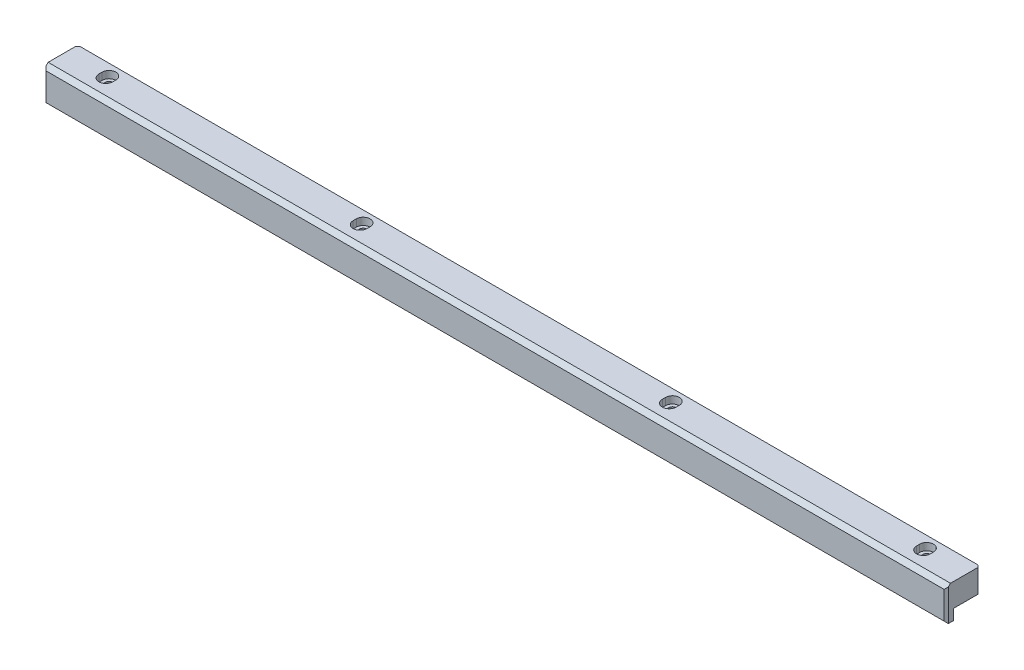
SolidWorks part; units mm, degrees
ref_plane "前视基准面" through (0, 0, 0) normal (0, 0, 1) x (1, 0, 0)
ref_plane "上视基准面" through (0, 0, 0) normal (0, 1, 0) x (1, 0, 0)
ref_plane "右视基准面" through (0, 0, 0) normal (1, 0, 0) x (0, 0, -1)
sketch "草图1" plane through (0, 0, 0) normal (0, 1, 0) x (1, 0, 0)
  line L1 (-213, 8) -> (213, 8)
  line L2 (-213, 8) -> (-213, -8)
  line L3 (-213, -8) -> (213, -8)
  line L4 (213, 8) -> (213, -8)
  line L5 (-213, 8) -> (213, -8) construction
  line L6 (-213, -8) -> (213, 8) construction
  point P0 (0, 0)
  dimension "D1" = 426
  dimension "D2" = 16
extrude "凸台-拉伸1" add sketch "草图1" along normal blind 16
sketch "草图19" plane through (0, 0, 0) normal (0, -1, 0) x (1, 0, 0)
  line L0 (213, 8) -> (213, -8) construction
  line L1 (-213, -8) -> (213, -8)
  line L2 (-213, -8) -> (-213, 4.5)
  line L3 (-213, 4.5) -> (213, 4.5)
  line L4 (213, -8) -> (213, 4.5)
  line L5 (-213, 8) -> (213, 8) construction
  dimension "D1" = 3.5
extrude "切除-拉伸5" cut sketch "草图19" against normal blind 5
sketch "草图16" plane through (0, 0, 0) normal (0, -1, 0) x (1, 0, 0)
  line L6 (181, -8) -> (161, -8)
  line L7 (181, -8) -> (181, 1.5)
  line L8 (181, 1.5) -> (161, 1.5)
  line L9 (161, -8) -> (161, 1.5)
  line L10 (213, 8) -> (213, 4.5) construction
  line L11 (-213, -8) -> (213, -8) construction
  point P15 (181, -3.25)
  dimension "D1" = 32
  dimension "D2" = 20
  dimension "D3" = 9.5
extrude "切除-拉伸4" [suppressed] cut sketch "草图16" against normal through all
fillet "圆角1" [suppressed] radius 2
chamfer "倒角1" distance 1 angle 45 1 edges at (0, 0, 8)
hole_wizard "M3 六角凹头螺钉的柱形沉头孔4" positions "草图24" profile "草图25" size "M3" standard "ISO"
sketch "草图24" plane through (0, 16, 0) normal (0, 1, 0) x (1, 0, 0)
  line L0 (193, 1.25) -> (193, 2.75) construction
  line L1 (213, -8) -> (213, 8) construction
  line L2 (213, 8) -> (-213, 8) construction
  line L3 (-213, 8) -> (-213, -8) construction
  line L4 (193, 2) -> (73, 2) construction
  line L7 (-73, 2) -> (-193, 2) construction
  point P0 (193, 2)
  point P16 (-193, 2)
  point P20 (-73, 2)
  point P22 (73, 2)
  dimension "D1" = 1.5
  dimension "D2" = 20
  dimension "D3" = 120
  dimension "D4" = 20
  dimension "D5" = 6
sketch "草图25" plane through (193, 16, -2) normal (1, 0, 0) x (0, 0, 1)
  line L0 (0, 0) -> (0, 16)
  line L1 (0, 16) -> (1.7, 16)
  line L3 (1.7, 16) -> (1.7, 3.4)
  line L4 (1.7, 3.4) -> (3.25, 3.4)
  line L5 (3.25, 3.4) -> (3.25, 0)
  line L7 (3.25, 0) -> (0, 0)
  line L11 (0, -6.35) -> (0, 107.95) construction
  dimension "通孔孔直径" = 3.4
  dimension "通孔孔深度" = 16
  dimension "柱形沉头孔直径" = 6.5
  dimension "柱形沉头孔深度" = 3.4
chamfer "倒角3" distance 2 angle 45 1 edges at (0, 16, 8)
chamfer "倒角2" distance 1 angle 45 4 edges at (213, 10.5, -8) (213, 7.5, 8) (-213, 7.5, 8) (-213, 10.5, -8)
sketch "草图30" plane through (0, 0, 8) normal (0, 0, 1) x (1, 0, 0)
  line L0 (-213, 16) -> (213, 16) construction
  line L1 (-168, 16) -> (-146, 16)
  line L2 (-168, 16) -> (-168, 0)
  line L3 (-168, 0) -> (-146, 0)
  line L4 (-146, 16) -> (-146, 0)
  line L5 (213, 0) -> (-213, 0) construction
  line L6 (-213, 0) -> (-213, 15) construction
  dimension "D1" = 22
  dimension "D2" = 45
extrude "切除-拉伸6" [suppressed] cut sketch "草图30" against normal blind 10
